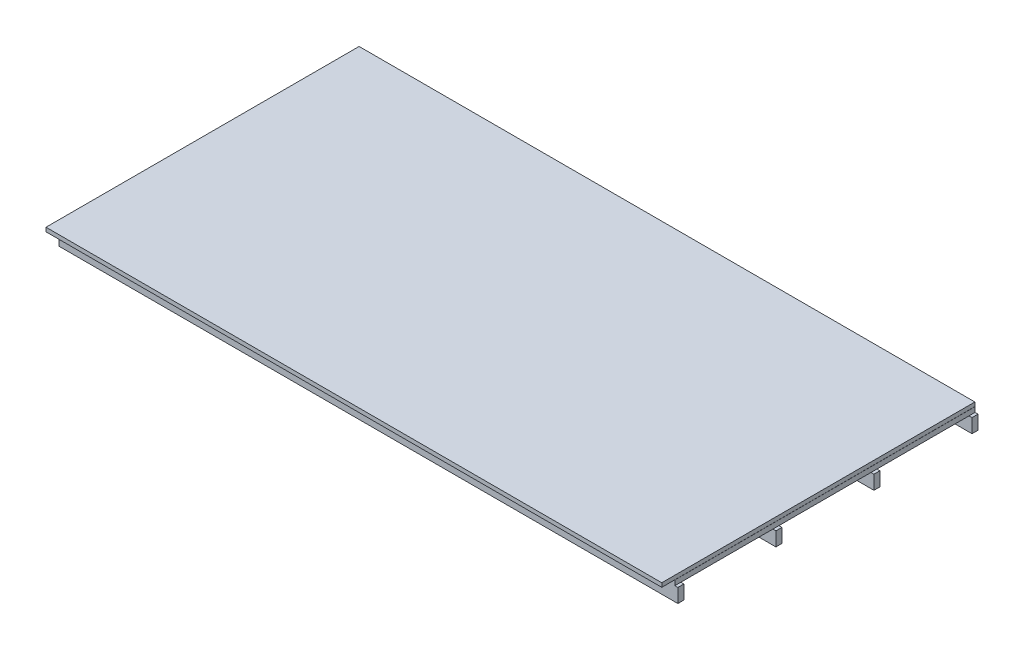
SolidWorks part; units mm, degrees
ref_plane "Front" through (0, 0, 0) normal (0, 0, 1) x (1, 0, 0)
ref_plane "Top" through (0, 0, 0) normal (0, 1, 0) x (1, 0, 0)
ref_plane "Right" through (0, 0, 0) normal (1, 0, 0) x (0, 0, -1)
sketch "Esquisse1" plane through (0, 0, 0) normal (1, 0, 0) x (0, 0, -1)
  line L0 (-846.8534, 0) -> (801.0776, 0) construction
  line L1 (-260.555, 0) -> (-230.555, 0)
  line L2 (-751.665, 0) -> (-721.665, 0)
  line L3 (-751.665, 0) -> (-751.665, 70)
  line L4 (-751.665, 70) -> (-721.665, 70)
  line L5 (-721.665, 0) -> (-721.665, 70)
  line L6 (-260.555, 0) -> (-260.555, 70)
  line L7 (-260.555, 70) -> (-230.555, 70)
  line L8 (-230.555, 0) -> (-230.555, 70)
  line L9 (0, 0) -> (0, 389.0948) construction
  line L10 (230.555, 0) -> (230.555, 70)
  line L11 (260.555, 70) -> (230.555, 70)
  line L12 (260.555, 0) -> (260.555, 70)
  line L13 (721.665, 0) -> (721.665, 70)
  line L14 (751.665, 70) -> (721.665, 70)
  line L15 (751.665, 0) -> (751.665, 70)
  line L16 (751.665, 0) -> (721.665, 0)
  line L17 (260.555, 0) -> (230.555, 0)
  point P3 (0, 0)
  point P4 (727.4138, 0)
  point P5 (-751.665, 0)
  point P10 (-260.555, 0)
  point P25 (260.555, 0)
  point P26 (751.665, 0)
  dimension "D1" = 1503.33
  dimension "D2" = 70
  dimension "D3" = 30
  dimension "D4" = 491.11
  dimension "D5" = 0
  dimension "D6" = 70
  dimension "D7" = 30
extrude "Boss.-Extru.1" add sketch "Esquisse1" along normal blind 3100
sketch "Esquisse2" plane through (0, 0, 751.665) normal (0, 0, 1) x (1, 0, 0)
  line L0 (510, 70) -> (535, 70)
  line L1 (0, 70) -> (25, 70)
  line L2 (0, 70) -> (0, 95)
  line L3 (0, 95) -> (25, 95)
  line L4 (25, 70) -> (25, 95)
  line L5 (510, 70) -> (510, 95)
  line L6 (510, 95) -> (535, 95)
  line L7 (535, 70) -> (535, 95)
  line L8 (1020, 70) -> (1045, 70)
  line L9 (1020, 70) -> (1020, 95)
  line L10 (1020, 95) -> (1045, 95)
  line L11 (1045, 70) -> (1045, 95)
  line L12 (1530, 70) -> (1555, 70)
  line L13 (1530, 70) -> (1530, 95)
  line L14 (1530, 95) -> (1555, 95)
  line L15 (1555, 70) -> (1555, 95)
  line L16 (2040, 70) -> (2065, 70)
  line L17 (2040, 70) -> (2040, 95)
  line L18 (2040, 95) -> (2065, 95)
  line L19 (2065, 70) -> (2065, 95)
  line L20 (2550, 70) -> (2575, 70)
  line L21 (2550, 70) -> (2550, 95)
  line L22 (2550, 95) -> (2575, 95)
  line L23 (2575, 70) -> (2575, 95)
  line L24 (3060, 70) -> (3085, 70)
  line L25 (3060, 70) -> (3060, 95)
  line L26 (3060, 95) -> (3085, 95)
  line L27 (3085, 70) -> (3085, 95)
  dimension "D1" = 25
  dimension "D2" = 25
  dimension "D3" = 7
extrude "Boss.-Extru.2" add sketch "Esquisse2" against normal up to vertex (1503.33 mm away)
sketch "Esquisse3" plane through (0, 95, 0) normal (0, 1, 0) x (1, 0, 0)
  line L1 (0, 751.665) -> (3084.3669, 751.665)
  line L2 (0, 751.665) -> (0, -816.6277)
  line L3 (0, -816.6277) -> (3084.3669, -816.6277)
  line L4 (3084.3669, 751.665) -> (3084.3669, -816.6277)
extrude "Boss.-Extru.3" add sketch "Esquisse3" along normal blind 20
